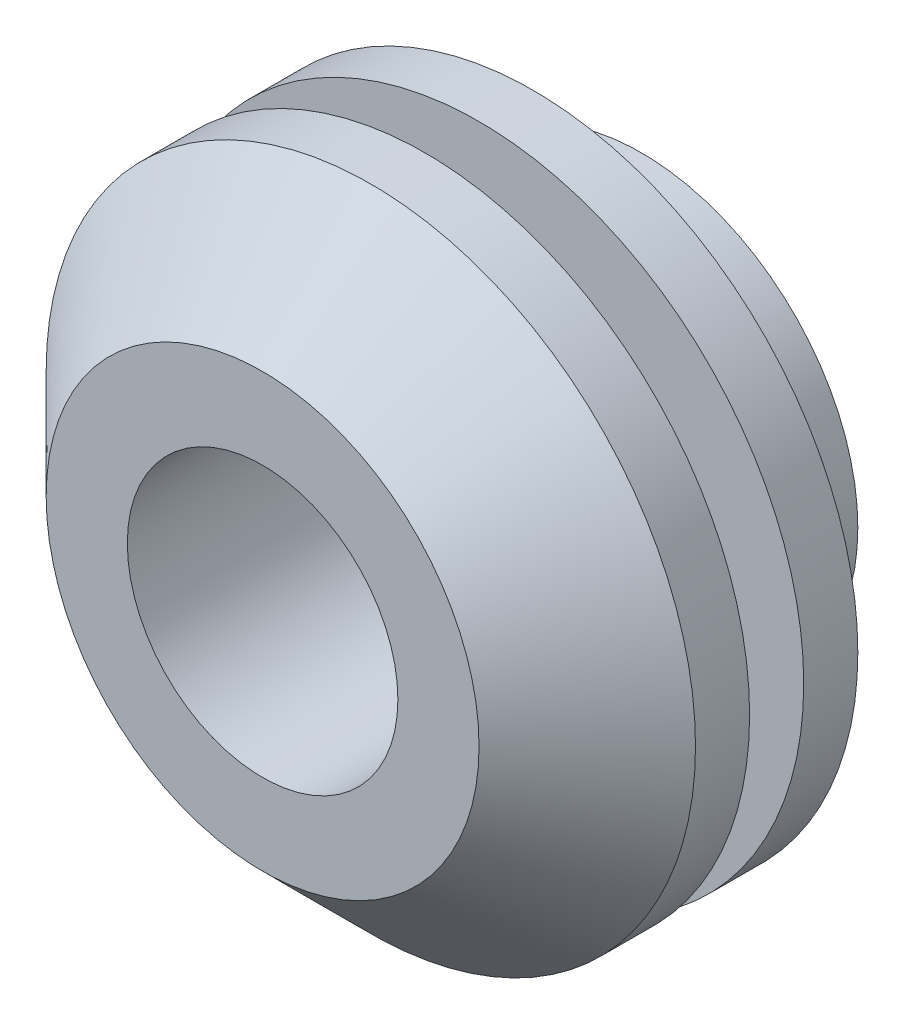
SolidWorks part; units mm, degrees
ref_plane "Plan1" through (0, 0, 0) normal (0, 0, 1) x (1, 0, 0)
ref_plane "Plan2" through (0, 0, 0) normal (0, 1, 0) x (1, 0, 0)
ref_plane "Plan3" through (0, 0, 0) normal (1, 0, 0) x (0, 0, -1)
sketch "Esquisse1" plane through (0, 0, 0) normal (0, 0, 1) x (1, 0, 0)
  circle A0 centre (0, 0) radius 2
  dimension "D1" = 4
extrude "Base-Extrusion" add sketch "Esquisse1" along normal blind 1
sketch "Esquisse2" plane through (0, 0, 1) normal (0, 0, 1) x (1, 0, 0)
  circle A0 centre (0, 0) radius 3
  dimension "D1" = 6
extrude "Boss.-Extru.1" add sketch "Esquisse2" along normal blind 0.5
sketch "Esquisse3" plane through (0, 0, 1.5) normal (0, 0, 1) x (1, 0, 0)
  circle A0 centre (0, 0) radius 2
  dimension "D1" = 4
extrude "Boss.-Extru.2" add sketch "Esquisse3" along normal blind 0.5
sketch "Esquisse4" plane through (0, 0, 2) normal (0, 0, 1) x (1, 0, 0)
  circle A0 centre (0, 0) radius 3
  dimension "D1" = 6
extrude "Boss.-Extru.3" add sketch "Esquisse4" along normal blind 1.5
chamfer "Chanfrein1" distance 1 angle 45 1 edges at (3, 0, 3.5)
sketch "Esquisse5" plane through (0, 0, 3.5) normal (0, 0, 1) x (1, 0, 0)
  circle A0 centre (0, 0) radius 1.25
  dimension "D1" = 2.5
extrude "Enlèv. mat.-Extru.1" cut sketch "Esquisse5" against normal through all
